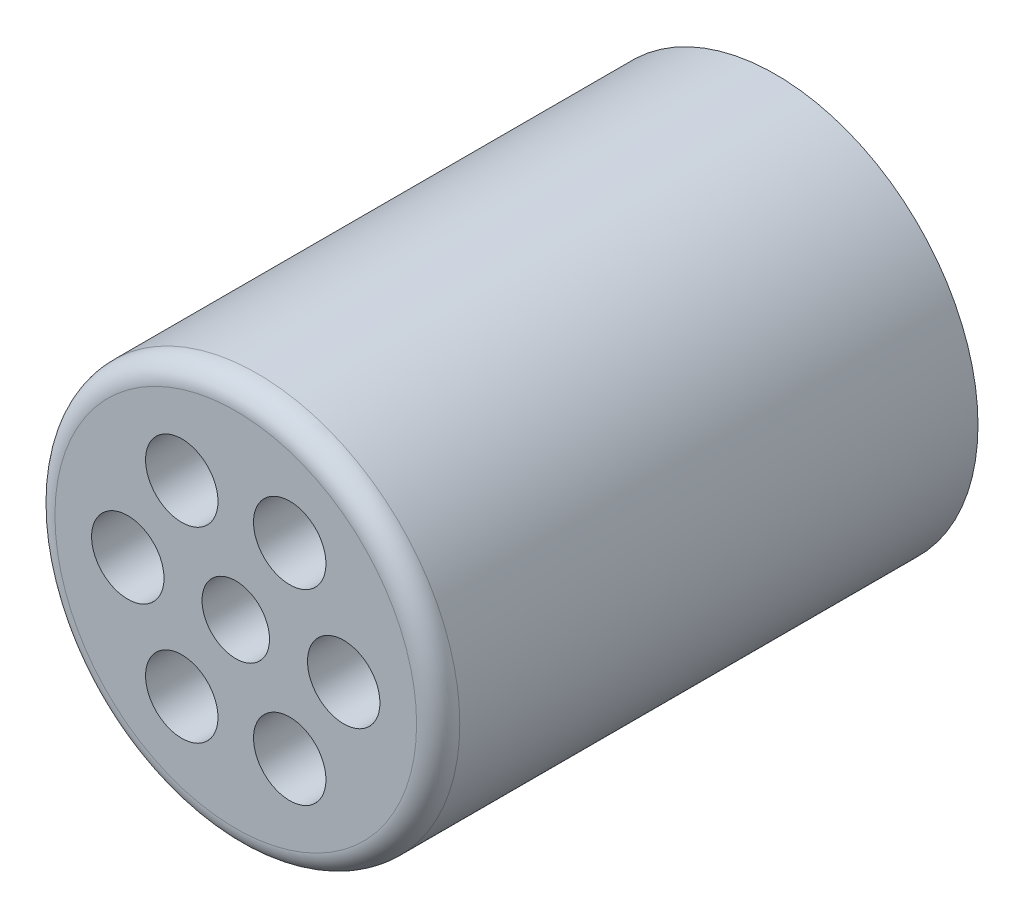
SolidWorks part; units mm, degrees
ref_plane "Front Plane" through (0, 0, 0) normal (0, 0, 1) x (1, 0, 0)
ref_plane "Top Plane" through (0, 0, 0) normal (0, 1, 0) x (1, 0, 0)
ref_plane "Right Plane" through (0, 0, 0) normal (1, 0, 0) x (0, 0, -1)
sketch "Sketch1" plane through (0, 0, 0) normal (0, 0, 1) x (1, 0, 0)
  circle A0 centre (0, 0) radius 4.7625
  dimension "D1" = 9.525
extrude "Extrude1" add sketch "Sketch1" along normal blind 12.7
sketch "Sketch2" plane through (0, 0, 12.7) normal (0, 0, 1) x (1, 0, 0)
  line L0 (0, 0) -> (6.1611, 0) construction
  circle A0 centre (0, 0) radius 0.7937
  circle A1 centre (2.54, 0) radius 0.8521
  circle A2 centre (1.27, -2.1997) radius 0.8521
  circle A3 centre (-1.27, -2.1997) radius 0.8521
  circle A4 centre (-2.54, 0) radius 0.8521
  circle A5 centre (-1.27, 2.1997) radius 0.8521
  circle A6 centre (1.27, 2.1997) radius 0.8521
  dimension "D1" = 1.5875
  dimension "D2" = 2.54
extrude "Cut-Extrude1" cut sketch "Sketch2" against normal blind 6.35
fillet "Fillet1" radius 0.508 1 edges at (4.7625, 0, 12.7)
